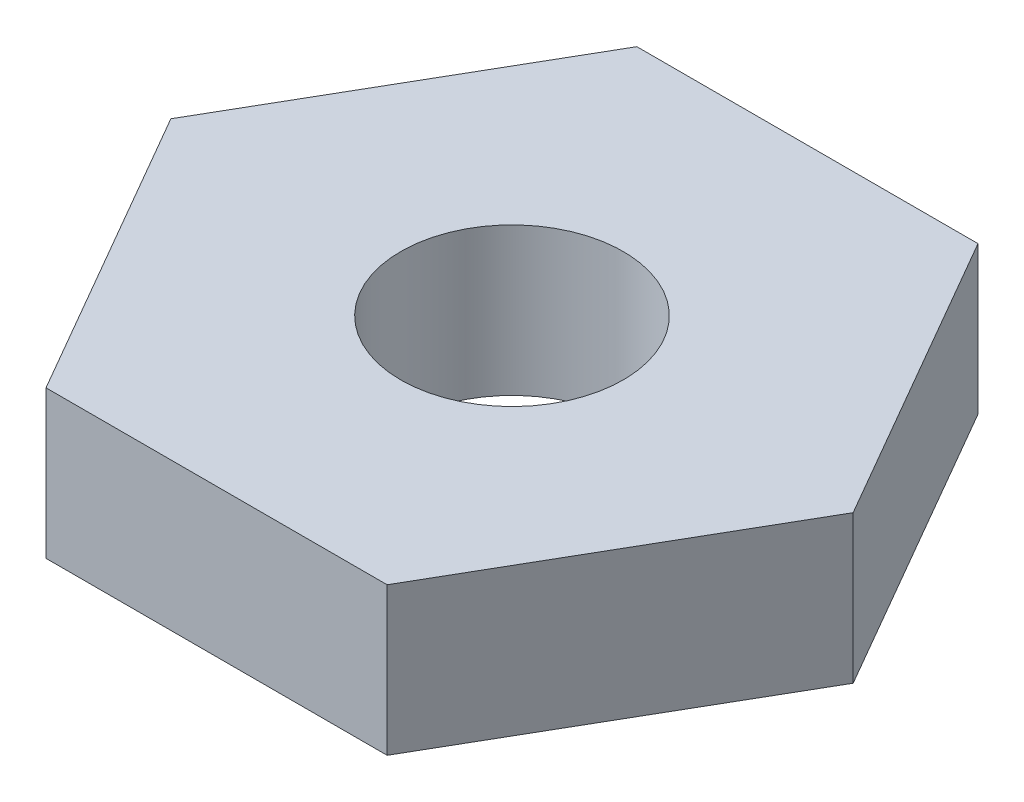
SolidWorks part; units mm, degrees
ref_plane "Front Plane" through (0, 0, 0) normal (0, 0, 1) x (1, 0, 0)
ref_plane "Top Plane" through (0, 0, 0) normal (0, 1, 0) x (1, 0, 0)
ref_plane "Right Plane" through (0, 0, 0) normal (1, 0, 0) x (0, 0, -1)
sketch "Sketch1" plane through (0, 0, 0) normal (0, 1, 0) x (1, 0, 0)
  line L1 (3.4641, 0) -> (1.7321, 3)
  line L2 (1.7321, 3) -> (-1.7321, 3)
  line L3 (-1.7321, 3) -> (-3.4641, 0)
  line L4 (-3.4641, 0) -> (-1.7321, -3)
  line L5 (-1.7321, -3) -> (1.7321, -3)
  line L6 (1.7321, -3) -> (3.4641, 0)
  circle A0 centre (0, 0) radius 3 construction
  circle A1 centre (0, 0) radius 1.13
  dimension "D2" = 2.26
  dimension "D1" = 6
extrude "Boss-Extrude1" add sketch "Sketch1" along normal blind 1.5
